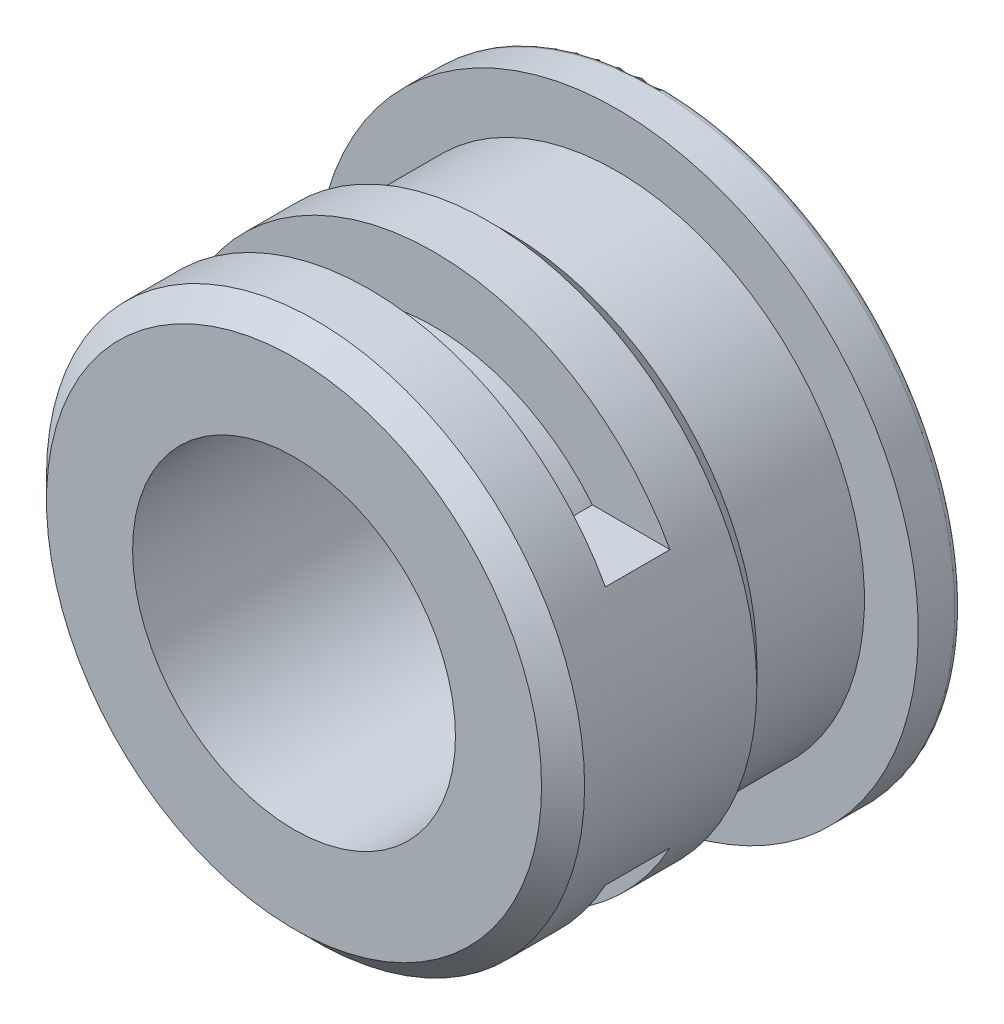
SolidWorks part; units mm, degrees
ref_plane "Plan1" through (0, 0, 0) normal (0, 0, 1) x (1, 0, 0)
ref_plane "Plan2" through (0, 0, 0) normal (0, 1, 0) x (1, 0, 0)
ref_plane "Plan3" through (0, 0, 0) normal (1, 0, 0) x (0, 0, -1)
sketch "Esquisse1" plane through (0, 0, 0) normal (0, 0, 1) x (1, 0, 0)
  circle A0 centre (0, 0) radius 6.25
  circle A1 centre (0, 0) radius 3.75
  dimension "D1" = 12.5
  dimension "D2" = 7.5
extrude "Base-Extrusion" add sketch "Esquisse1" along normal blind 7.5
sketch "Esquisse2" plane through (0, 0, 0) normal (0, 0, -1) x (-1, 0, 0)
  circle A0 centre (0, 0) radius 7
  dimension "D1" = 14
extrude "Boss.-Extru.1" add sketch "Esquisse2" along normal blind 1
sketch "Esquisse3" plane through (0, 0, 0) normal (1, 0, 0) x (0, 0, -1)
  line L0 (0, 7) -> (0, -7) construction
  line L1 (0, 6.25) -> (-2.5, 6.25)
  line L2 (0, 6.25) -> (0, 5.75)
  line L3 (0, 5.75) -> (-2.5, 5.75)
  line L4 (-2.5, 6.25) -> (-2.5, 5.75)
  line L5 (0, 6.25) -> (-7.5, 6.25) construction
  line L6 (0, 0) -> (-22.9238, 0) construction
  line L7 (-7.5, 0) -> (0, 0) construction
  dimension "D1" = 0.5
  dimension "D2" = 2.5
revolve "Enlèvement de matière-Révolution1" cut sketch "Esquisse3" angle 360 about L6
chamfer "Chanfrein1" distance 0.5 angle 45
ref_plane "Plan4" through (0, 0, 5) normal (0, 0, 1) x (1, 0, 0)
sketch "Esquisse4" plane through (0, 0, 5) normal (0, 0, 1) x (1, 0, 0)
  line L1 (-5.4829, 3) -> (-3.6827, 3)
  line L2 (-5.4829, 3) -> (-5.4829, -3) construction
  line L3 (-5.4829, -3) -> (-3.6827, -3)
  line L4 (-3.6827, 3) -> (-3.6827, -3) construction
  line L5 (3.6827, 3) -> (5.4829, 3)
  line L6 (3.6827, 3) -> (3.6827, -3) construction
  line L7 (3.6827, -3) -> (5.4829, -3)
  line L8 (5.4829, 3) -> (5.4829, -3) construction
  circle A0 centre (0, 0) radius 6.25 construction
  arc A1 (-5.4829, -3) -> (5.4829, -3) centre (0, 0) ccw
  arc A2 (-3.6827, -3) -> (3.6827, -3) centre (0, 0) ccw
  arc A3 (3.6827, 3) -> (-3.6827, 3) centre (0, 0) ccw
  arc A4 (5.4829, 3) -> (-5.4829, 3) centre (0, 0) ccw
  point P12 (-3.6827, 0)
  point P13 (3.6827, 0)
  dimension "D1" = 9.5
  dimension "D2" = 6
  dimension "D3" = 6
extrude "Enlèv. mat.-Extru.1" cut sketch "Esquisse4" against normal mid plane 1.5
sketch "Esquisse5" plane through (0, 0, -1) normal (0, 0, -1) x (-1, 0, 0)
  text T0 "-MIN-" font "Century Gothic" height 3.5
  dimension "D1" = 1.708
  dimension "D2" = 6.5
extrude "Boss.-Extru.2" add sketch "Esquisse5" along normal blind 0.3
fillet "Congé3" radius 0.15
